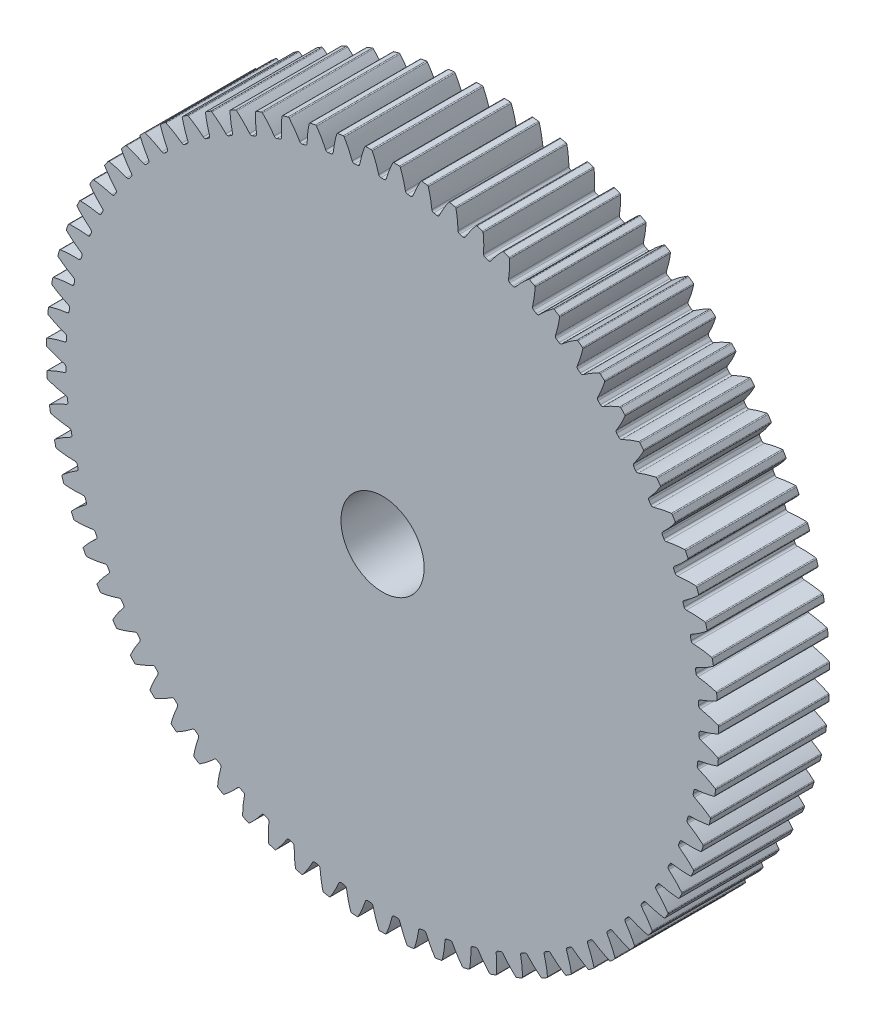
SolidWorks part; units mm, degrees
ref_plane "Front" through (0, 0, 0) normal (0, 0, 1) x (1, 0, 0)
ref_plane "Top" through (0, 0, 0) normal (0, 1, 0) x (1, 0, 0)
ref_plane "Right" through (0, 0, 0) normal (1, 0, 0) x (0, 0, -1)
sketch "Sketch1" plane through (0, 0, 0) normal (0, 0, 1) x (1, 0, 0)
  circle A0 centre (0, 0) radius 38.5
extrude "Boss-Extrude1" add sketch "Sketch1" along normal blind 12.7
sketch "Sketch3" plane through (0, 0, 0) normal (0, 0, 1) x (1, 0, 0)
  line L0 (0, 0) -> (43.7181, 0) construction
  line L2 (0, 0) -> (-0.2189, 36.2493) construction
  line L3 (0, 0) -> (0.2189, 36.2493) construction
  line L4 (0.2189, 36.2493) -> (0.2128, 35.2378) construction
  line L5 (0, 0) -> (0, 61.276) construction
  line L6 (-0.2189, 36.2493) -> (-0.2128, 35.2378) construction
  circle A0 centre (0, 0) radius 38.5 construction
  circle A1 centre (0, 0) radius 37.5 construction
  circle A2 centre (0, 0) radius 35.2385 construction
  arc A3 (0.2189, 36.2493) -> (-0.2189, 36.2493) centre (0, 0) ccw construction
  arc A5 (1.2144, 38.4808) -> (-1.2144, 38.4808) centre (0, 0) ccw
  spline S0 degree 4 poles (-0.2128, 35.2378) (-0.2129, 35.2429) (-0.2133, 35.257) (-0.2145, 35.2838) (-0.2174, 35.3274) (-0.2223, 35.383) (-0.2299, 35.4549) (-0.2407, 35.5396) (-0.2545, 35.6326) (-0.2714, 35.7339) (-0.2901, 35.8348) (-0.3104, 35.9356) (-0.3322, 36.0359) (-0.3603, 36.1575) (-0.3964, 36.3032) (-0.4423, 36.4735) (-0.4986, 36.6666) (-0.5604, 36.8634) (-0.6251, 37.0571) (-0.6947, 37.2527) (-0.7652, 37.4419) (-0.8428, 37.6384) (-0.9167, 37.8198) (-1.0044, 38.023) (-1.0766, 38.1869) (-1.1771, 38.4032) (-1.238, 38.5309) (-1.3112, 38.6803) (-1.3446, 38.7467) (-1.3652, 38.7876) knots 0 0 0 0 0 0.005377 0.015084 0.028532 0.04661 0.064855 0.092111 0.119476 0.146842 0.174209 0.201575 0.228941 0.256307 0.307035 0.361767 0.4165 0.471232 0.525964 0.580697 0.635429 0.690161 0.744894 0.799626 0.854358 0.909091 0.954545 1 1 1 1 1 construction
  spline S1 degree 4 poles (-0.2128, 35.2378) (-0.2129, 35.2429) (-0.2133, 35.257) (-0.2145, 35.2838) (-0.2174, 35.3274) (-0.2223, 35.383) (-0.2299, 35.4549) (-0.2407, 35.5396) (-0.2545, 35.6326) (-0.2714, 35.7339) (-0.2901, 35.8348) (-0.3104, 35.9356) (-0.3322, 36.0359) (-0.3603, 36.1575) (-0.3964, 36.3032) (-0.4423, 36.4735) (-0.4986, 36.6666) (-0.5604, 36.8634) (-0.6251, 37.0571) (-0.6947, 37.2527) (-0.7652, 37.4419) (-0.8428, 37.6384) (-0.9167, 37.8198) (-1.0044, 38.023) (-1.0766, 38.1869) (-1.1553, 38.3563) (-1.1942, 38.4387) (-1.2144, 38.4808) knots 0 0 0 0 0 0.005377 0.015084 0.028532 0.04661 0.064855 0.092111 0.119476 0.146842 0.174209 0.201575 0.228941 0.256307 0.307035 0.361767 0.4165 0.471232 0.525964 0.580697 0.635429 0.690161 0.744894 0.799626 0.854358 0.909091 0.909091 0.909091 0.909091 0.909091
  spline S2 degree 4 poles (0.2128, 35.2378) (0.2129, 35.2429) (0.2133, 35.257) (0.2145, 35.2838) (0.2174, 35.3274) (0.2223, 35.383) (0.2299, 35.4549) (0.2407, 35.5396) (0.2545, 35.6326) (0.2714, 35.7339) (0.2901, 35.8348) (0.3104, 35.9356) (0.3322, 36.0359) (0.3603, 36.1575) (0.3964, 36.3032) (0.4423, 36.4735) (0.4986, 36.6666) (0.5604, 36.8634) (0.6251, 37.0571) (0.6947, 37.2527) (0.7652, 37.4419) (0.8428, 37.6384) (0.9167, 37.8198) (1.0044, 38.023) (1.0766, 38.1869) (1.1771, 38.4032) (1.238, 38.5309) (1.3112, 38.6803) (1.3446, 38.7467) (1.3652, 38.7876) knots 0 0 0 0 0 0.005377 0.015084 0.028532 0.04661 0.064855 0.092111 0.119476 0.146842 0.174209 0.201575 0.228941 0.256307 0.307035 0.361767 0.4165 0.471232 0.525964 0.580697 0.635429 0.690161 0.744894 0.799626 0.854358 0.909091 0.954545 1 1 1 1 1 construction
  spline S3 degree 4 poles (0.2128, 35.2378) (0.2129, 35.2429) (0.2133, 35.257) (0.2145, 35.2838) (0.2174, 35.3274) (0.2223, 35.383) (0.2299, 35.4549) (0.2407, 35.5396) (0.2545, 35.6326) (0.2714, 35.7339) (0.2901, 35.8348) (0.3104, 35.9356) (0.3322, 36.0359) (0.3603, 36.1575) (0.3964, 36.3032) (0.4423, 36.4735) (0.4986, 36.6666) (0.5604, 36.8634) (0.6251, 37.0571) (0.6947, 37.2527) (0.7652, 37.4419) (0.8428, 37.6384) (0.9167, 37.8198) (1.0044, 38.023) (1.0766, 38.1869) (1.1553, 38.3563) (1.1942, 38.4387) (1.2144, 38.4808) knots 0 0 0 0 0 0.005377 0.015084 0.028532 0.04661 0.064855 0.092111 0.119476 0.146842 0.174209 0.201575 0.228941 0.256307 0.307035 0.361767 0.4165 0.471232 0.525964 0.580697 0.635429 0.690161 0.744894 0.799626 0.854358 0.909091 0.909091 0.909091 0.909091 0.909091
sketch "DCLTBC" [suppressed] plane through (0, 0, 0) normal (0, 0, 1) x (1, 0, 0)
  line L0 (0, 0) -> (41.04, 0) construction
  line L1 (-0.5882, 26.2434) -> (-0.5952, 26.5563) construction
  line L2 (0.5882, 26.2434) -> (0.5952, 26.5563) construction
  line L3 (-0.5936, 26.4814) -> (-0.5952, 26.5563)
  line L4 (0.5936, 26.4814) -> (0.5952, 26.5563)
  line L5 (0, 0) -> (0, 104.9356) construction
  circle A0 centre (0, 0) radius 28.5
  circle A1 centre (0, 0) radius 27.5 construction
  circle A2 centre (0, 0) radius 26.563 construction
  arc A3 (0.5882, 26.2434) -> (-0.5882, 26.2434) centre (0, 0) ccw construction
  arc A4 (0.3512, 26.2477) -> (-0.3512, 26.2477) centre (0, 0) ccw
  arc A5 (-0.5936, 26.4814) -> (-0.3512, 26.2477) centre (-0.3544, 26.4868) ccw
  arc A7 (0.5936, 26.4814) -> (0.3512, 26.2477) centre (0.3544, 26.4868) cw
  spline S0 degree 4 poles (-999.0854, -27.9057) (-10.5882, 25.1883) (-0.7108, 25.7707) (-0.5671, 26.1913) (-0.5985, 26.609) (-0.6016, 26.6417) (-0.6063, 26.6839) (-0.6128, 26.7337) (-0.6209, 26.7885) (-0.6307, 26.8481) (-0.6414, 26.9075) (-0.653, 26.9669) (-0.6654, 27.026) (-0.6812, 27.0976) (-0.7015, 27.1836) (-0.7271, 27.2842) (-0.7584, 27.3983) (-0.7927, 27.5147) (-0.8284, 27.6294) (-0.8667, 27.7454) (-0.9054, 27.8577) (-0.948, 27.9745) (-0.9884, 28.0824) (-1.0364, 28.2034) (-1.2469, 28.7251) (-2.0615, 30.5023) (8.679, 5.7048) (-401.0337, 945.0216) knots -0.712101 -0.712101 -0.712101 -0.712101 -0.712101 0.005377 0.015084 0.028532 0.04661 0.064855 0.092111 0.119476 0.146842 0.174209 0.201575 0.228941 0.256307 0.307035 0.361767 0.4165 0.471232 0.525964 0.580697 0.635429 0.690161 0.744894 0.799626 0.854358 1.858481 1.858481 1.858481 1.858481 1.858481 only from (-0.5952, 26.5563) to (-1.151, 28.4767) construction
  spline S1 degree 4 poles (999.0854, -27.9056) (10.5882, 25.1883) (0.7108, 25.7707) (0.5671, 26.1913) (0.5985, 26.609) (0.6016, 26.6417) (0.6063, 26.6839) (0.6128, 26.7337) (0.6209, 26.7885) (0.6307, 26.8481) (0.6414, 26.9075) (0.653, 26.9669) (0.6654, 27.026) (0.6812, 27.0976) (0.7015, 27.1836) (0.7271, 27.2842) (0.7584, 27.3983) (0.7927, 27.5147) (0.8284, 27.6294) (0.8667, 27.7454) (0.9054, 27.8577) (0.948, 27.9745) (0.9884, 28.0824) (1.0364, 28.2034) (1.2469, 28.7251) (2.0615, 30.5023) (-8.679, 5.7048) (401.0337, 945.0216) knots -0.712101 -0.712101 -0.712101 -0.712101 -0.712101 0.005377 0.015084 0.028532 0.04661 0.064855 0.092111 0.119476 0.146842 0.174209 0.201575 0.228941 0.256307 0.307035 0.361767 0.4165 0.471232 0.525964 0.580697 0.635429 0.690161 0.744894 0.799626 0.854358 1.858481 1.858481 1.858481 1.858481 1.858481 only from (0.5952, 26.5563) to (1.151, 28.4767) construction
  spline S2 degree 4 poles (-0.5952, 26.5563) (-0.5953, 26.5593) (-0.5957, 26.5676) (-0.5966, 26.5833) (-0.5985, 26.609) (-0.6016, 26.6417) (-0.6063, 26.6839) (-0.6128, 26.7337) (-0.6209, 26.7885) (-0.6307, 26.8481) (-0.6414, 26.9075) (-0.653, 26.9669) (-0.6654, 27.026) (-0.6812, 27.0976) (-0.7015, 27.1836) (-0.7271, 27.2842) (-0.7584, 27.3983) (-0.7927, 27.5147) (-0.8284, 27.6294) (-0.8667, 27.7454) (-0.9054, 27.8577) (-0.948, 27.9745) (-0.9884, 28.0824) (-1.0364, 28.2034) (-1.0758, 28.3012) (-1.1188, 28.4023) (-1.14, 28.4516) (-1.151, 28.4767) knots 0 0 0 0 0 0.005377 0.015084 0.028532 0.04661 0.064855 0.092111 0.119476 0.146842 0.174209 0.201575 0.228941 0.256307 0.307035 0.361767 0.4165 0.471232 0.525964 0.580697 0.635429 0.690161 0.744894 0.799626 0.854358 0.909091 0.909091 0.909091 0.909091 0.909091
  spline S3 degree 4 poles (0.5952, 26.5563) (0.5953, 26.5593) (0.5957, 26.5676) (0.5966, 26.5833) (0.5985, 26.609) (0.6016, 26.6417) (0.6063, 26.6839) (0.6128, 26.7337) (0.6209, 26.7885) (0.6307, 26.8481) (0.6414, 26.9075) (0.653, 26.9669) (0.6654, 27.026) (0.6812, 27.0976) (0.7015, 27.1836) (0.7271, 27.2842) (0.7584, 27.3983) (0.7927, 27.5147) (0.8284, 27.6294) (0.8667, 27.7454) (0.9054, 27.8577) (0.948, 27.9745) (0.9884, 28.0824) (1.0364, 28.2034) (1.0758, 28.3012) (1.1188, 28.4023) (1.14, 28.4516) (1.151, 28.4767) knots 0 0 0 0 0 0.005377 0.015084 0.028532 0.04661 0.064855 0.092111 0.119476 0.146842 0.174209 0.201575 0.228941 0.256307 0.307035 0.361767 0.4165 0.471232 0.525964 0.580697 0.635429 0.690161 0.744894 0.799626 0.854358 0.909091 0.909091 0.909091 0.909091 0.909091
  dimension "D1" = 0.255
extrude "Cut-Extrude-DCLTBC" [suppressed] cut sketch "DCLTBC" along normal through all contours L4 S3 A0 S2 L3 A5 A4 A7
fillet "Fillet-DCLTBC" [suppressed] radius 0.1275
pattern_circular "CirPattern-DCLTBC" [suppressed] count 75 over 360
sketch "DCGTBC" plane through (0, 0, 0) normal (0, 0, 1) x (1, 0, 0)
  line L0 (0, 0) -> (41.04, 0) construction
  line L5 (0, 0) -> (0, 104.9356) construction
  circle A0 centre (0, 0) radius 38.5
  circle A1 centre (0, 0) radius 37.5 construction
  circle A2 centre (0, 0) radius 35.2385 construction
  arc A3 (0.2189, 36.2493) -> (-0.2189, 36.2493) centre (0, 0) ccw construction
  arc A5 (0.1858, 36.2495) -> (0.4329, 36.4367) centre (0.1871, 36.5045) ccw
  arc A7 (-0.4329, 36.4367) -> (-0.1858, 36.2495) centre (-0.1871, 36.5045) ccw
  arc A11 (0.1858, 36.2495) -> (-0.1858, 36.2495) centre (0, 0) ccw
  spline S2 degree 4 poles (-999.5892, 0.782) (-12.109, 33.4947) (-0.3825, 34.1128) (-0.1774, 34.7194) (-0.2174, 35.3274) (-0.2223, 35.383) (-0.2299, 35.4549) (-0.2407, 35.5396) (-0.2545, 35.6326) (-0.2714, 35.7339) (-0.2901, 35.8348) (-0.3104, 35.9356) (-0.3322, 36.0359) (-0.3603, 36.1575) (-0.3964, 36.3032) (-0.4423, 36.4735) (-0.4986, 36.6666) (-0.5604, 36.8634) (-0.6251, 37.0571) (-0.6947, 37.2527) (-0.7652, 37.4419) (-0.8428, 37.6384) (-0.9167, 37.8198) (-1.0044, 38.023) (-1.3496, 38.8068) (-2.5728, 41.2423) (10.8268, 12.9929) (-432.9289, 940.454) knots -0.602737 -0.602737 -0.602737 -0.602737 -0.602737 0.005377 0.015084 0.028532 0.04661 0.064855 0.092111 0.119476 0.146842 0.174209 0.201575 0.228941 0.256307 0.307035 0.361767 0.4165 0.471232 0.525964 0.580697 0.635429 0.690161 0.744894 0.799626 0.854358 1.736781 1.736781 1.736781 1.736781 1.736781 only from (-0.2128, 35.2378) to (-1.2144, 38.4808) construction
  spline S3 degree 4 poles (999.5892, 0.782) (12.109, 33.4947) (0.3825, 34.1128) (0.1774, 34.7194) (0.2174, 35.3274) (0.2223, 35.383) (0.2299, 35.4549) (0.2407, 35.5396) (0.2545, 35.6326) (0.2714, 35.7339) (0.2901, 35.8348) (0.3104, 35.9356) (0.3322, 36.0359) (0.3603, 36.1575) (0.3964, 36.3032) (0.4423, 36.4735) (0.4986, 36.6666) (0.5604, 36.8634) (0.6251, 37.0571) (0.6947, 37.2527) (0.7652, 37.4419) (0.8428, 37.6384) (0.9167, 37.8198) (1.0044, 38.023) (1.3496, 38.8068) (2.5728, 41.2423) (-10.8268, 12.9929) (432.9289, 940.454) knots -0.602737 -0.602737 -0.602737 -0.602737 -0.602737 0.005377 0.015084 0.028532 0.04661 0.064855 0.092111 0.119476 0.146842 0.174209 0.201575 0.228941 0.256307 0.307035 0.361767 0.4165 0.471232 0.525964 0.580697 0.635429 0.690161 0.744894 0.799626 0.854358 1.736781 1.736781 1.736781 1.736781 1.736781 only from (0.2128, 35.2378) to (1.2144, 38.4808) construction
  spline S4 degree 4 poles (-0.4329, 36.4367) (-0.442, 36.4696) (-0.4652, 36.552) (-0.5037, 36.6831) (-0.5604, 36.8634) (-0.6251, 37.0571) (-0.6947, 37.2527) (-0.7652, 37.4419) (-0.8428, 37.6384) (-0.9167, 37.8198) (-1.0044, 38.023) (-1.0766, 38.1869) (-1.1553, 38.3563) (-1.1942, 38.4387) (-1.2144, 38.4808) knots 0.325325 0.325325 0.325325 0.325325 0.325325 0.361767 0.4165 0.471232 0.525964 0.580697 0.635429 0.690161 0.744894 0.799626 0.854358 0.909091 0.909091 0.909091 0.909091 0.909091
  spline S5 degree 4 poles (0.4329, 36.4367) (0.442, 36.4696) (0.4652, 36.552) (0.5037, 36.6831) (0.5604, 36.8634) (0.6251, 37.0571) (0.6947, 37.2527) (0.7652, 37.4419) (0.8428, 37.6384) (0.9167, 37.8198) (1.0044, 38.023) (1.0766, 38.1869) (1.1553, 38.3563) (1.1942, 38.4387) (1.2144, 38.4808) knots 0.325325 0.325325 0.325325 0.325325 0.325325 0.361767 0.4165 0.471232 0.525964 0.580697 0.635429 0.690161 0.744894 0.799626 0.854358 0.909091 0.909091 0.909091 0.909091 0.909091
  dimension "D1" = 0.255
extrude "Cut-Extrude-DCGTBC" cut sketch "DCGTBC" along normal through all contours A5 S5 A0 S4 A7 A11
fillet "Fillet-DCGTBC" radius 0.1275 2 edges at (1.2144, 38.4808, 6.35) (-1.2144, 38.4808, 6.35)
pattern_circular "CirPattern-DCGTBC" count 75 over 360 about axis through (0, 0, 12.7) along (0, 0, 1) of "Cut-Extrude-DCGTBC", "Fillet-DCGTBC"
sketch "Sketch4" plane through (0, 0, 12.7) normal (0, 0, 1) x (1, 0, 0)
  circle A0 centre (0, 0) radius 4.7625
  dimension "D1" = 9.525
extrude "Cut-Extrude2" cut sketch "Sketch4" against normal through all
equation "\"DiametralPitch\"= 25.4'Diametral Pitch"
equation "\"NumTeeth\"= 75'Number of Teeth"
equation "\"PressureAngle\"= 20deg'Pressure Angle"
equation "\"Addendum\"= 1 / \"DiametralPitch\"'Addendum"
equation "\"Dedendum\"= 1.25 / \"DiametralPitch\"'Dedendum"
equation "\"WorkingDepth\"= 2 / \"DiametralPitch\"'Working Depth - here for REF (Not used in building model)"
equation "\"WholeDepth\"= 2.25 / \"DiametralPitch\"'Whole Depth - here for REF (Not used in building model)"
equation "\"Clearance\"= .19 / \"DiametralPitch\"'Clearance"
equation "\"CircularPitch\"= pi / \"DiametralPitch\"'Circular Pitch - here for REF (Not used in building model)"
equation "\"PitchCircle\"= \"NumTeeth\" / \"DiametralPitch\"'Pitch Circle - or - Pitch Diameter"
equation "\"OutsideDiameter\"= ( \"NumTeeth\" + 2 ) / \"DiametralPitch\"'Outside Diameter"
equation "\"Fillet\"= \"Clearance\" * cos ( \"PressureAngle\" ) * tan ( ( 90 + \"PressureAngle\" ) / 2 )'Fillet"
equation "\"AddendumCircle\"= \"PitchCircle\" + ( 2 * \"Addendum\" )'Addendum Circle - or - Addendum Diameter"
equation "\"DedendumCircle\"= \"PitchCircle\" - ( 2 * \"Dedendum\" )'Dedendum Circle - or - Dedendum Diameter"
equation "\"BaseCircle\"= \"PitchCircle\" * cos ( \"PressureAngle\" )'Base Circle - Base Diameter"
equation "\"PitchAngle\"= 360deg / \"NumTeeth\"'Pitch Angle"
equation "\"Alpha\"= sqr ( \"PitchCircle\" ^ 2 - \"BaseCircle\" ^ 2 ) / \"BaseCircle\" * 180 / PI - \"PressureAngle\"'Alpha - Used for Calculating Beta"
equation "\"Beta\"= ( \"PitchAngle\" / 4 - ( \"Alpha\" - 90 ) )'Beta - Used in definition of the parameters for the parametric equation driven curve"
equation "\"Gamma\"= ( \"PitchAngle\" / 4 - ( \"Alpha\" + 90 ) )'Gamma - Used in definition of the parameters for the parametric equation driven curve"
equation "\"Phi\"= sqr ( ( \"AddendumCircle\" / 2 ) ^ 2 - ( \"BaseCircle\" / 2 ) ^ 2 ) / ( \"BaseCircle\" / 2 )'Phi - Used in definition of the parameters for the parametric equation driven curve"
equation "\"DCGTBC\"= iif ( ( \"DedendumCircle\" + ( \"Fillet\" * 2 ) ) > \"BaseCircle\" , \"unsuppressed\" , \"suppressed\" )'if Dedendum Circle +2X Fillet IS GREATER THAN BaseCircle THEN Unsuppress OR Suppress FEATURE"
equation "\"DCLTBC\"= iif ( ( \"DedendumCircle\" + ( \"Fillet\" * 2 ) ) > \"BaseCircle\" , \"suppressed\" , \"unsuppressed\" )'if Dedendum Circle +2X Fillet IS GREATER THAN BaseCircle THEN Suppress OR Unsuppress FEATURE"
equation "\"Cut-Extrude-DCGTBC\"= iif ( ( \"DedendumCircle\" + ( \"Fillet\" * 2 ) ) > \"BaseCircle\" , \"unsuppressed\" , \"suppressed\" )'if Dedendum Circle +2X Fillet IS GREATER THAN BaseCircle THEN UnsuppressORSuppress "
equation "\"Cut-Extrude-DCLTBC\"= iif ( ( \"DedendumCircle\" + ( \"Fillet\" * 2 ) ) > \"BaseCircle\" , \"suppressed\" , \"unsuppressed\" )'if Dedendum Circle +2X Fillet IS GREATER THAN BaseCircle THEN SuppressORUnsuppress "
equation "\"CirPattern-DCGTBC\"= iif ( ( \"DedendumCircle\" + ( \"Fillet\" * 2 ) ) > \"BaseCircle\" , \"unsuppressed\" , \"suppressed\" )'if Dedendum Circle +2X Fillet IS GREATER THAN \"BaseCircle\" THEN UnsuppressORSuppress"
equation "\"CirPattern-DCLTBC\"= iif ( ( \"DedendumCircle\" + ( \"Fillet\" * 2 ) ) > \"BaseCircle\" , \"suppressed\" , \"unsuppressed\" )'if Dedendum Circle +2X Fillet IS GREATER THAN \"BaseCircle\" THEN SuppressORUnsuppress"
equation "\"Fillet-DCGTBC\"= iif ( ( \"DedendumCircle\" + ( \"Fillet\" * 2 ) ) > \"BaseCircle\" , \"unsuppressed\" , \"suppressed\" )'if Dedendum Circle +2X Fillet IS GREATER THAN \"BaseCircle\" THEN UnsuppressORSuppress FEA"
equation "\"Fillet-DCLTBC\"= iif ( ( \"DedendumCircle\" + ( \"Fillet\" * 2 ) ) > \"BaseCircle\" , \"suppressed\" , \"unsuppressed\" )'if Dedendum Circle +2X Fillet IS GREATER THAN \"BaseCircle\" THEN SuppressORUnsuppress FEA"
equation "\"D1@CirPattern-DCGTBC\"=\"NumTeeth\""
equation "\"D1@CirPattern-DCLTBC\"=\"NumTeeth\""
equation "\"D1@DCGTBC\"=\"Fillet\""
equation "\"D1@DCLTBC\"=\"Fillet\""
equation "\"D1@Fillet-DCLTBC\"=\"Fillet\"/2"
equation "\"D1@Fillet-DCGTBC\"=\"Fillet\"/2"
